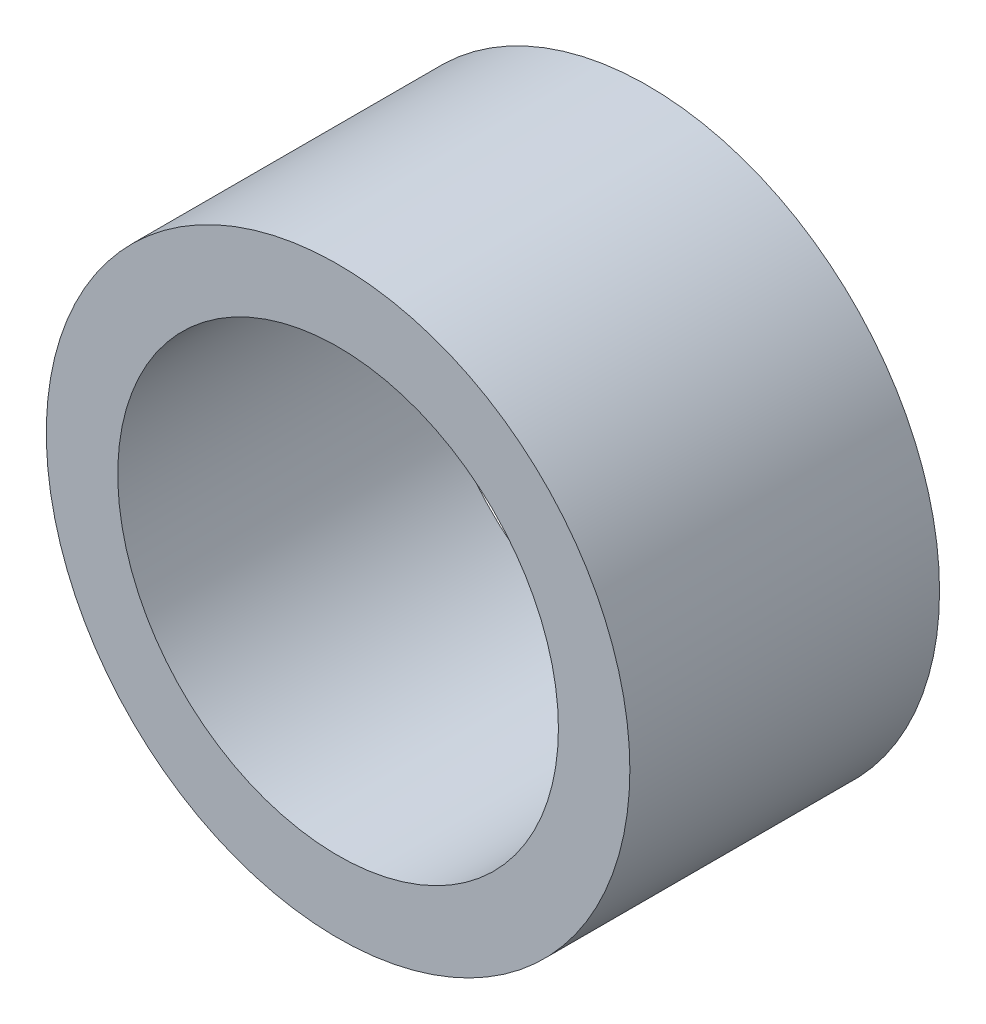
SolidWorks part; units mm, degrees
ref_plane "Face" through (0, 0, 0) normal (0, 0, 1) x (1, 0, 0)
ref_plane "Dessus" through (0, 0, 0) normal (0, 1, 0) x (1, 0, 0)
ref_plane "Droite" through (0, 0, 0) normal (1, 0, 0) x (0, 0, -1)
sketch "Esquisse1" plane through (0, 0, 0) normal (0, 0, 1) x (1, 0, 0)
  circle A0 centre (0, 0) radius 9.25
  dimension "D1" = 18.5
extrude "Extru.-Mince1" add sketch "Esquisse1" against normal blind 13 thin
